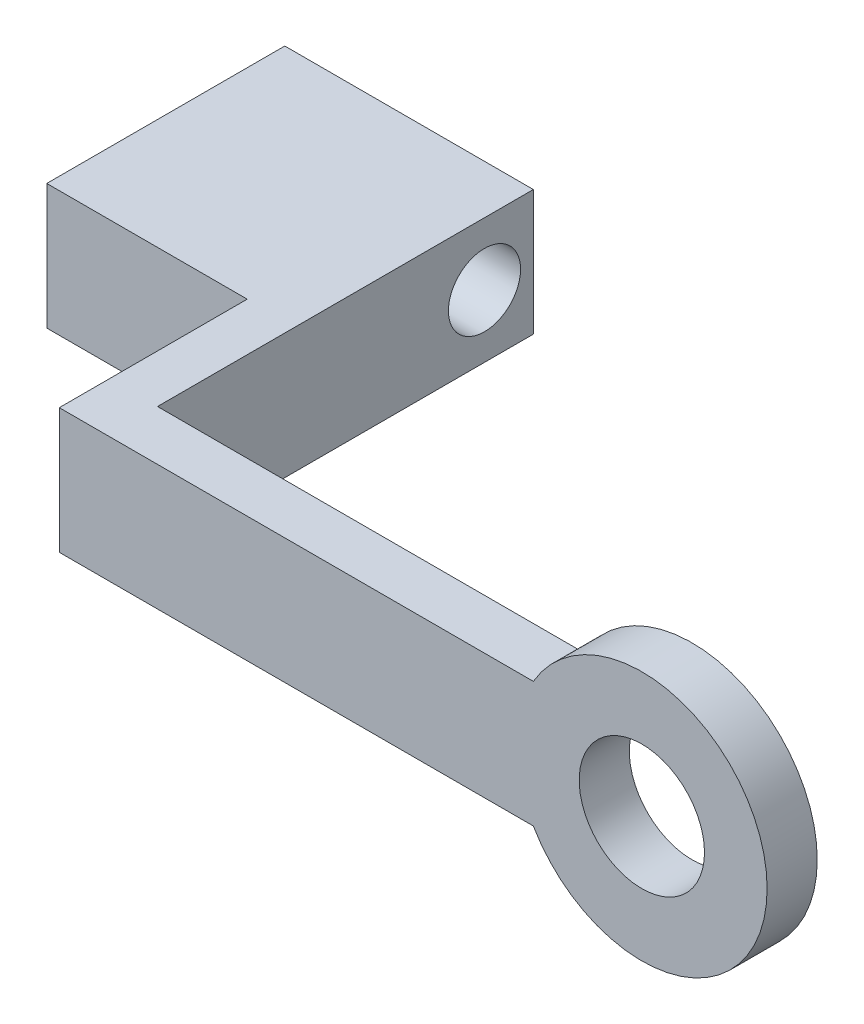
SolidWorks part; units mm, degrees
ref_plane "Front Plane" through (0, 0, 0) normal (0, 0, 1) x (1, 0, 0)
ref_plane "Top Plane" through (0, 0, 0) normal (0, 1, 0) x (1, 0, 0)
ref_plane "Right Plane" through (0, 0, 0) normal (1, 0, 0) x (0, 0, -1)
sketch "Sketch1" plane through (0, 0, 0) normal (0, 0, 1) x (1, 0, 0)
  line L0 (-16.3406, 0) -> (7.83, 0) construction
  line L1 (-15.6593, 3.175) -> (-5.4993, 3.175)
  line L2 (-15.6593, 3.175) -> (-15.6593, -3.175)
  line L3 (-15.6593, -3.175) -> (-5.4993, -3.175)
  line L5 (0, 8.911) -> (0, -7.1228) construction
  circle A0 centre (0, 0) radius 3.175
  arc A1 (-5.4993, -3.175) -> (-5.4993, 3.175) centre (0, 0) ccw
  dimension "D1" = 6.35
  dimension "D2" = 12.7
  dimension "D3" = 6.35
  dimension "D4" = 10.16
extrude "Boss-Extrude1" add sketch "Sketch1" along normal blind 2.54
sketch "Sketch2" plane through (-15.6593, 0, 0) normal (-1, 0, 0) x (0, 0, 1)
  line L0 (2.54, -6.35) -> (2.54, 6.35) construction
  line L1 (-19.05, 3.175) -> (2.54, 3.175)
  line L2 (-19.05, 3.175) -> (-19.05, -3.175)
  line L3 (-19.05, -3.175) -> (2.54, -3.175)
  line L4 (2.54, 3.175) -> (2.54, -3.175)
  line L5 (-17.3174, 0) -> (5.0548, 0) construction
  line L6 (0, 6.35) -> (0, -6.35) construction
  circle A0 centre (-16.5735, 0) radius 1.8288
  dimension "D6" = 3.6576
  dimension "D1" = 21.59
  dimension "D2" = 6.35
  dimension "D4" = 16.5735
extrude "Boss-Extrude2" add sketch "Sketch2" along normal blind 24.0284
sketch "Sketch3" plane through (-15.6593, 0, 0) normal (1, 0, 0) x (0, 0, -1)
  line L1 (0, 3.175) -> (19.05, 3.175)
  line L2 (0, 3.175) -> (0, -3.175)
  line L3 (0, -3.175) -> (19.05, -3.175)
  line L4 (19.05, 3.175) -> (19.05, -3.175)
extrude "Cut-Extrude1" cut sketch "Sketch3" against normal blind 11.43
sketch "Sketch5" plane through (-39.6877, 0, 0) normal (-1, 0, 0) x (0, 0, 1)
  line L0 (2.54, 3.175) -> (-19.05, 3.175) construction
  line L1 (-6.985, 3.175) -> (2.54, 3.175)
  line L2 (-6.985, 3.175) -> (-6.985, -3.175)
  line L3 (-6.985, -3.175) -> (2.54, -3.175)
  line L4 (2.54, 3.175) -> (2.54, -3.175)
  dimension "D1" = 9.525
extrude "Cut-Extrude2" cut sketch "Sketch5" against normal blind 10.16
sketch "Sketch6" plane through (-39.6877, 0, 0) normal (-1, 0, 0) x (0, 0, 1)
  line L0 (-16.5735, 5.1545) -> (-16.5735, -5.1545) construction
  line L1 (-20.0555, 0) -> (4.1423, 0) construction
  line L2 (142.1765, 0) -> (-46.6258, 0) construction
  line L3 (142.1765, 0) -> (-39.7489, 48.7468) construction
  line L4 (142.1765, 0) -> (-35.8579, -47.7042) construction
  line L5 (-11.5735, 50.8) -> (-4.8709, 50.8)
  line L6 (-11.5735, -50.8) -> (-4.8709, -50.8)
  circle A0 centre (142.1765, 0) radius 158.75 construction
  circle A1 centre (-11.1642, 41.0875) radius 1.8288
  arc A2 (-11.5735, 50.8) -> (-11.5735, -50.8) centre (142.1765, 0) ccw
  arc A3 (-4.8709, 50.8) -> (-4.8709, -50.8) centre (142.1765, 0) ccw
  circle A4 centre (-11.1642, -41.0875) radius 1.8288
  circle A5 centre (-16.5735, 0) radius 1.8288
  point P9 (-16.5735, 0)
  dimension "D1" = 317.5
  dimension "D2" = 311.15
  dimension "D3" = 323.85
  dimension "D7" = 3.6576
  dimension "D8" = 3.6576
  dimension "D9" = 3.6576
  dimension "D4" = 15
  dimension "D5" = 15
  dimension "D6" = 101.6
extrude "Boss-Extrude3" [suppressed] add sketch "Sketch6" against normal blind 4.445
